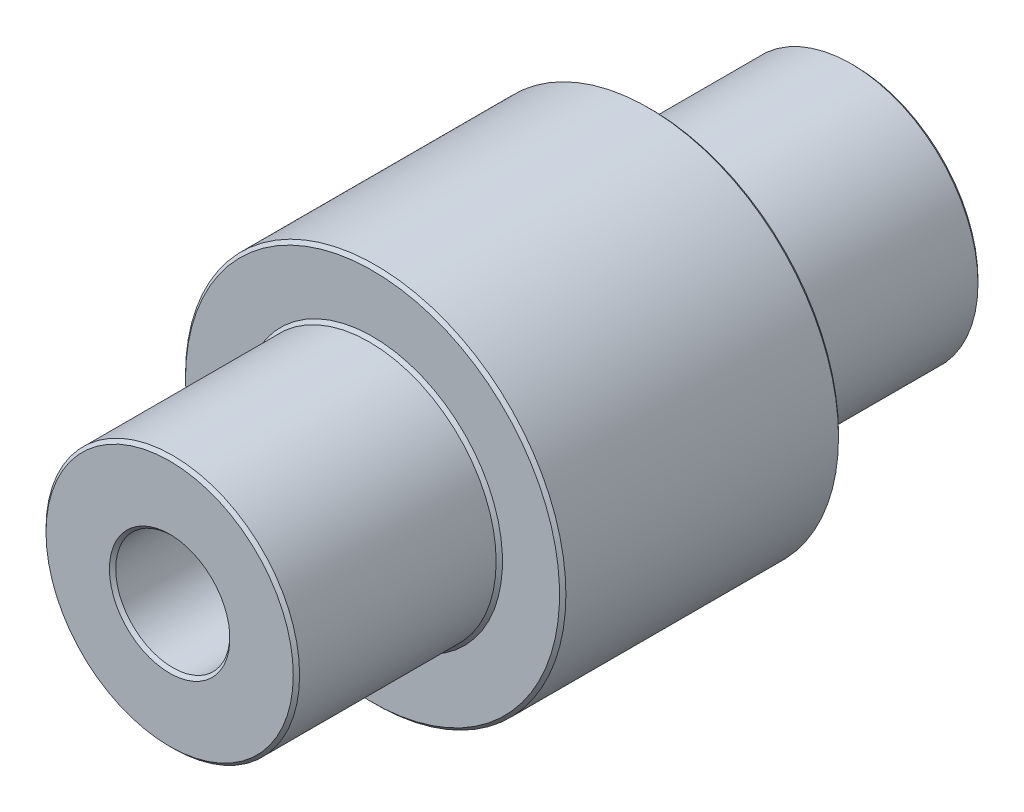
SolidWorks part; units mm, degrees
ref_plane "Спереди" through (0, 0, 0) normal (0, 0, 1) x (1, 0, 0)
ref_plane "Сверху" through (0, 0, 0) normal (0, 1, 0) x (1, 0, 0)
ref_plane "Справа" through (0, 0, 0) normal (1, 0, 0) x (0, 0, -1)
sketch "Эскиз1" plane through (0, 0, 0) normal (1, 0, 0) x (0, 0, -1)
  line L0 (-27, 0) -> (27, 0) construction
  line L1 (-27, 4.5) -> (27, 4.5)
  line L2 (27, 4.5) -> (27, 10)
  line L3 (27, 10) -> (11, 10)
  line L4 (11, 10) -> (11, 15)
  line L5 (11, 15) -> (-11, 15)
  line L6 (-11, 15) -> (-11, 10)
  line L7 (-11, 10) -> (-27, 10)
  line L8 (-27, 10) -> (-27, 4.5)
  dimension "D1" = 54
  dimension "D2" = 9
  dimension "D3" = 20
  dimension "D4" = 30
  dimension "D5" = 22
revolve "Повернуть1" add sketch "Эскиз1" angle 360 about L0
chamfer "Фаска1" distance 0.25 angle 45 8 edges at (10, 0, -27) (10, 0, -11) (10, 0, 11) (10, 0, 27) (15, 0, -11) (15, 0, 11) (4.5, 0, 27) (4.5, 0, -27)
